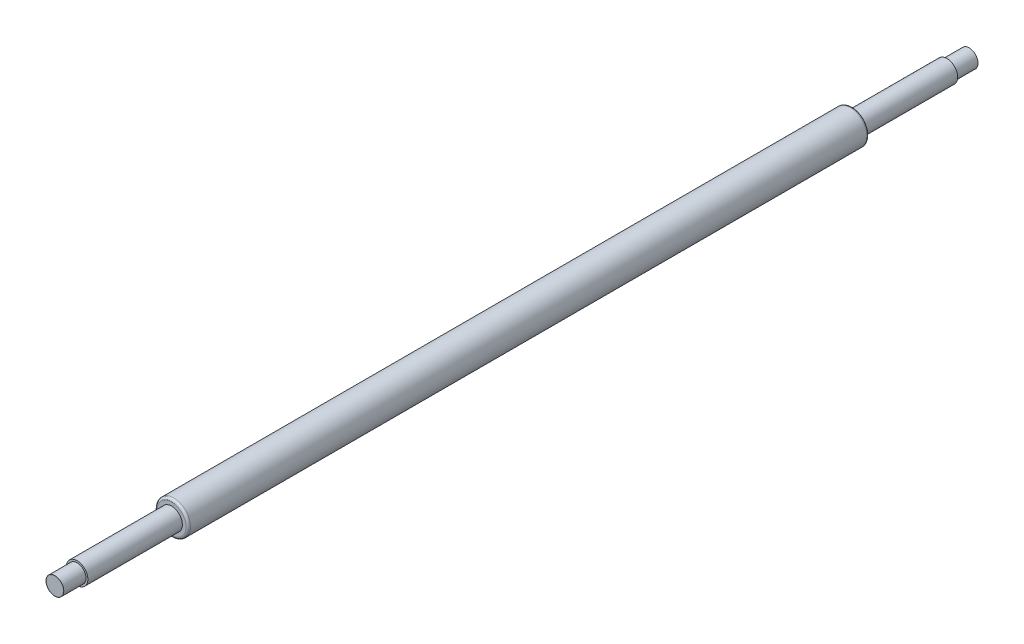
SolidWorks part; units mm, degrees
ref_plane "Front Plane" through (0, 0, 0) normal (0, 0, 1) x (1, 0, 0)
ref_plane "Top Plane" through (0, 0, 0) normal (0, 1, 0) x (1, 0, 0)
ref_plane "Right Plane" through (0, 0, 0) normal (1, 0, 0) x (0, 0, -1)
sketch "Sketch1" plane through (0, 0, 0) normal (0, 0, 1) x (1, 0, 0)
  circle A0 centre (0, 0) radius 9.525
  dimension "D1" = 19.05
extrude "Boss-Extrude1" add sketch "Sketch1" along normal blind 522.224
sketch "Sketch2" plane through (0, 0, 522.224) normal (0, 0, 1) x (1, 0, 0)
  circle A0 centre (0, 0) radius 6.1595
  circle A1 centre (0, 0) radius 9.525
  dimension "D1" = 12.319
  dimension "D2" = 19.05
extrude "Cut-Extrude1" cut sketch "Sketch2" against normal blind 66.675
sketch "Sketch3" plane through (0, 0, 0) normal (0, 0, -1) x (-1, 0, 0)
  circle A0 centre (0, 0) radius 6.1595
  circle A1 centre (0, 0) radius 9.525
  dimension "D1" = 12.319
  dimension "D2" = 19.05
extrude "Cut-Extrude2" cut sketch "Sketch3" against normal blind 66.675
fillet "Fillet1" radius 1.27 4 edges at (-9.525, 0, 66.675) (9.525, 0, 455.549) (-6.1595, 0, 0) (6.1595, 0, 522.224)
sketch "Sketch4" plane through (0, 0, 0) normal (0, 0, -1) x (-1, 0, 0)
  circle A0 centre (0, 0) radius 5.08
  circle A1 centre (0, 0) radius 6.1595
  dimension "D1" = 10.16
  dimension "D2" = 12.319
extrude "Cut-Extrude3" cut sketch "Sketch4" against normal blind 12.7
sketch "Sketch5" plane through (0, 0, 522.224) normal (0, 0, 1) x (1, 0, 0)
  circle A0 centre (0, 0) radius 5.08
  circle A1 centre (0, 0) radius 6.1595
  dimension "D1" = 10.16
  dimension "D2" = 12.319
extrude "Cut-Extrude4" cut sketch "Sketch5" against normal blind 12.7
